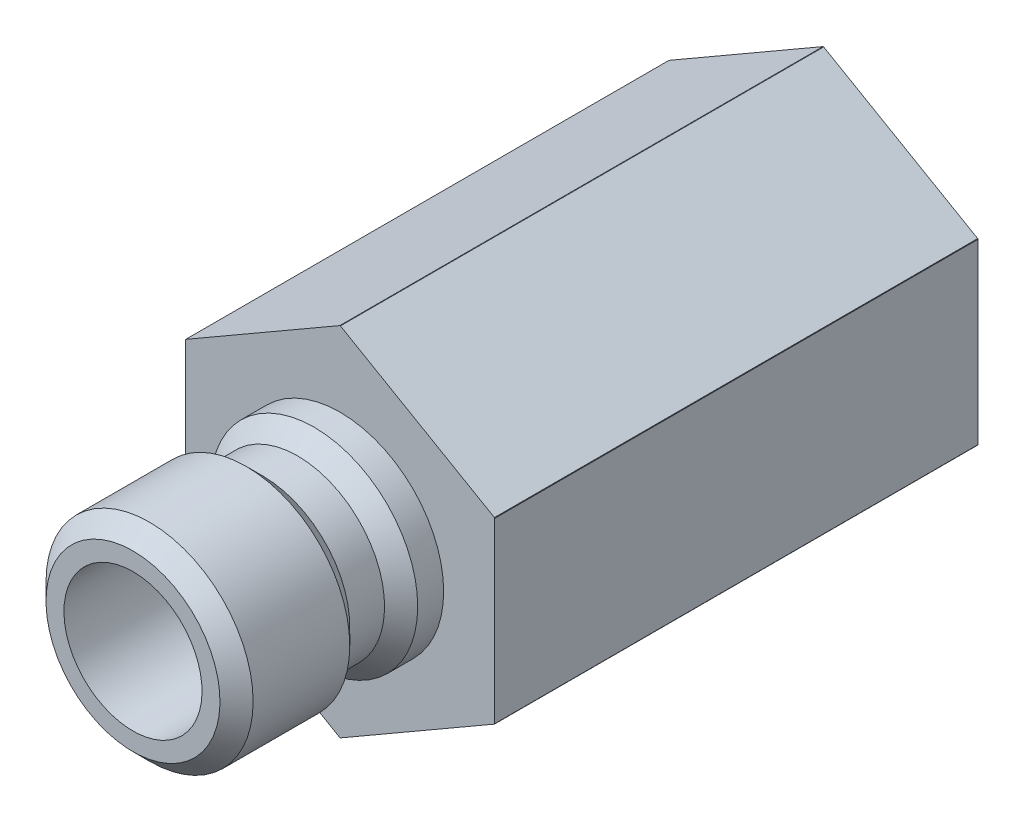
SolidWorks part; units mm, degrees
ref_plane "Front Plane" through (0, 0, 0) normal (0, 0, 1) x (1, 0, 0)
ref_plane "Top Plane" through (0, 0, 0) normal (0, 1, 0) x (1, 0, 0)
ref_plane "Right Plane" through (0, 0, 0) normal (1, 0, 0) x (0, 0, -1)
sketch "Sketch1" plane through (0, 0, 0) normal (1, 0, 0) x (0, 0, -1)
  line L0 (0, 0) -> (-12.7, 0) construction
  line L1 (-9.525, 3.175) -> (-9.525, 4.0005)
  line L2 (-3.556, 4.0005) -> (-3.556, 0) construction
  line L3 (-8.763, 4.7625) -> (-4.318, 4.7625)
  line L4 (0, 8.2042) -> (0, 0) construction
  line L5 (-3.556, 4.0005) -> (-1.9558, 4.0005)
  line L6 (-1.1938, 4.7625) -> (0, 4.7625)
  line L7 (0, 4.7625) -> (0, 8.2042)
  line L8 (-3.556, 4.0005) -> (-4.318, 4.7625)
  line L9 (-1.9558, 4.0005) -> (-1.1938, 4.7625)
  line L10 (-9.525, 4.0005) -> (-8.763, 4.7625)
  line L11 (-9.525, 3.175) -> (10.6045, 3.175)
  line L12 (0, 8.2042) -> (22.225, 8.2042)
  line L13 (10.6045, 3.175) -> (10.6045, 5.5753)
  line L14 (22.225, 8.2042) -> (22.225, 5.9384)
  line L15 (10.6045, 5.5753) -> (22.225, 5.9384)
  dimension "D11" = 1.79
  dimension "D1" = 9.525
  dimension "D2" = 1.6002
  dimension "D3" = 0.762
  dimension "D4" = 45
  dimension "D5" = 5.969
  dimension "D6" = 45
  dimension "D7" = 16.4084
  dimension "D8" = 11.1506
  dimension "D9" = 31.75
  dimension "D10" = 3.175
  dimension "D12" = 6.35
  dimension "D13" = 11.6205
  dimension "D14" = 9.525
revolve "Revolve1" add sketch "Sketch1" angle 360 about L0
sketch "Sketch2" plane through (0, 0, 0) normal (0, 0, 1) x (1, 0, 0)
  line L1 (-7.112, 4.1061) -> (-7.112, -4.1061)
  line L2 (-7.112, -4.1061) -> (0, -8.2122)
  line L3 (0, -8.2122) -> (7.112, -4.1061)
  line L4 (7.112, -4.1061) -> (7.112, 4.1061)
  line L5 (7.112, 4.1061) -> (0, 8.2122)
  line L6 (0, 8.2122) -> (-7.112, 4.1061)
  circle A0 centre (0, 0) radius 7.112 construction
  dimension "D1" = 14.224
extrude "Cut-Extrude1" cut sketch "Sketch2" against normal through all flip side to cut
